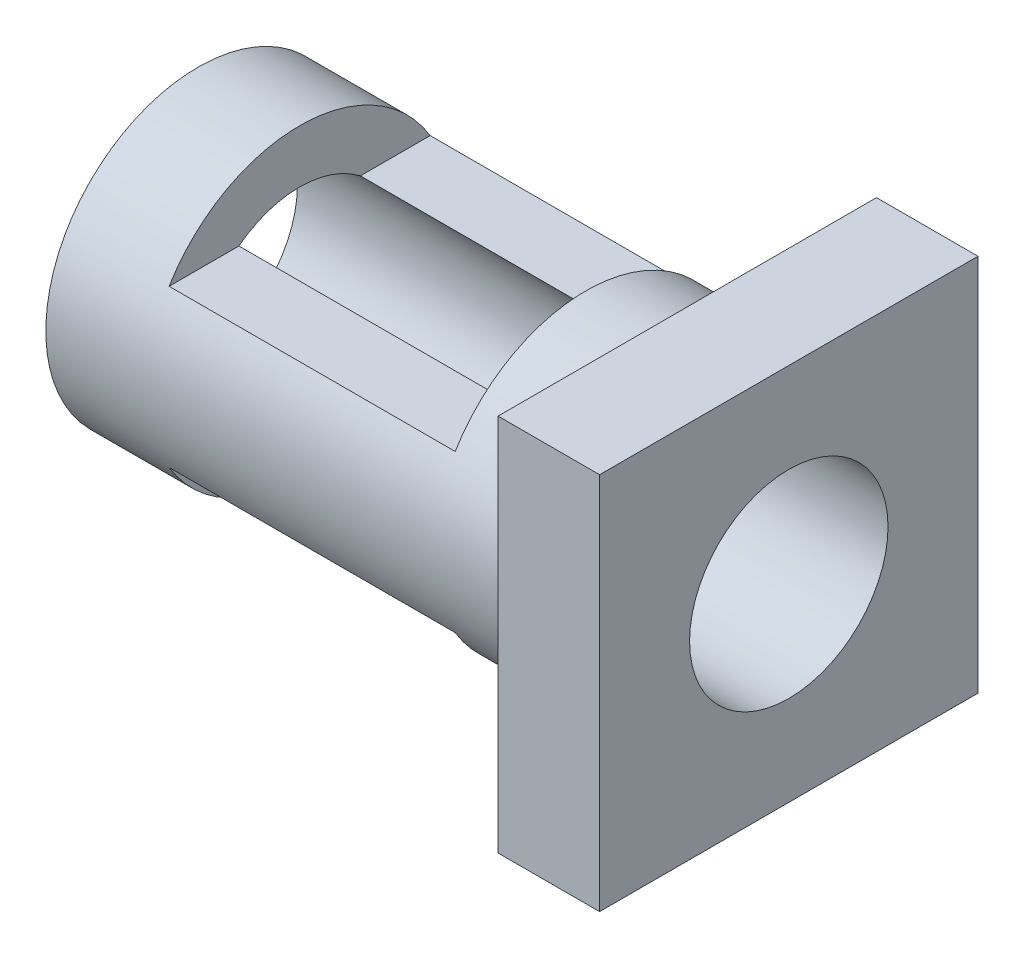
SolidWorks part; units mm, degrees
ref_plane "前视基准面" through (0, 0, 0) normal (0, 0, 1) x (1, 0, 0)
ref_plane "上视基准面" through (0, 0, 0) normal (0, 1, 0) x (1, 0, 0)
ref_plane "右视基准面" through (0, 0, 0) normal (1, 0, 0) x (0, 0, -1)
sketch "草图1" plane through (0, 0, 0) normal (1, 0, 0) x (0, 0, -1)
  circle A0 centre (0, 0) radius 66
extrude "拉伸1" add sketch "草图1" against normal blind 212
sketch "草图2" plane through (0, 0, 0) normal (1, 0, 0) x (0, 0, -1)
  line L1 (-82, 82) -> (82, 82)
  line L2 (-82, 82) -> (-82, -82)
  line L3 (-82, -82) -> (82, -82)
  line L4 (82, 82) -> (82, -82)
  dimension "D1" = 164
  dimension "D2" = 82
  dimension "D3" = 82
extrude "拉伸2" add sketch "草图2" along normal blind 44
sketch "草图3" plane through (-212, 0, 0) normal (-1, 0, 0) x (0, 0, 1)
  circle A0 centre (0, 0) radius 43
extrude "切除-拉伸1" cut sketch "草图3" against normal through all
sketch "草图4" plane through (0, 0, 0) normal (0, 0, 1) x (1, 0, 0)
  line L0 (-212, 66) -> (-212, -66) construction
  line L1 (-168, 79.1252) -> (-44, 79.1252)
  line L2 (-168, 79.1252) -> (-168, 34)
  line L3 (-168, 34) -> (-44, 34)
  line L4 (-44, 79.1252) -> (-44, 34)
  line L5 (-168, -34) -> (-44, -34)
  line L6 (-168, -34) -> (-168, -85.1695)
  line L7 (-168, -85.1695) -> (-44, -85.1695)
  line L8 (-44, -34) -> (-44, -85.1695)
  line L9 (0, 66) -> (-212, 66) construction
  line L10 (-212, -66) -> (0, -66) construction
  dimension "D1" = 44
  dimension "D2" = 124
  dimension "D3" = 32
  dimension "D4" = 44
  dimension "D5" = 124
  dimension "D6" = 32
extrude "切除-拉伸2" cut sketch "草图4" against normal through all and the other way through all
